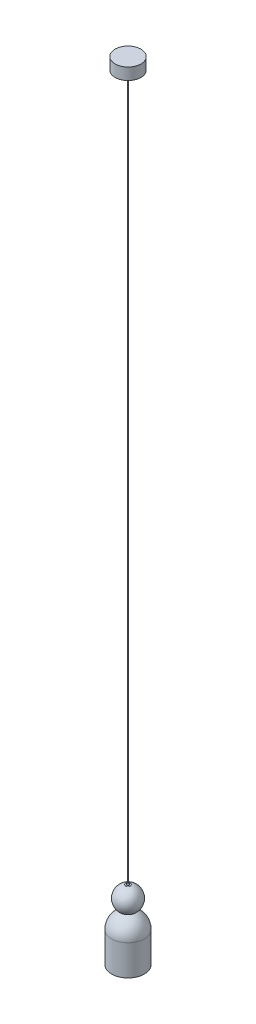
SolidWorks part; units mm, degrees
ref_plane "Alzado" through (0, 0, 0) normal (0, 0, 1) x (1, 0, 0)
ref_plane "Planta" through (0, 0, 0) normal (0, 1, 0) x (1, 0, 0)
ref_plane "Vista lateral" through (0, 0, 0) normal (1, 0, 0) x (0, 0, -1)
sketch "Croquis1" plane through (0, 0, 0) normal (0, 0, 1) x (1, 0, 0)
  line L0 (0, 0) -> (-70, 0)
  line L1 (0, 0) -> (0, 200)
  line L2 (0, 200) -> (0, 160.6502)
  line L3 (-70, 0) -> (-70, 130)
  arc A1 (0, 200) -> (-70, 130) centre (0, 130) ccw
revolve "Revolución1" add sketch "Croquis1" angle 360 about L1
shell "Vaciado1" thickness 3
ref_plane "Plano1" through (0, 200, 0) normal (0, 1, 0) x (1, 0, 0)
sketch "Croquis2" plane through (0, 0, 0) normal (1, 0, 0) x (0, 0, -1)
  line L0 (0, 195.2557) -> (0, 295.2557)
  arc A0 (0, 295.2557) -> (0, 195.2557) centre (0, 245.2557) ccw
revolve "Revolución2" add sketch "Croquis2" angle 360 about L0
ref_plane "Plano2" through (0, 295, 0) normal (0, 1, 0) x (1, 0, 0)
sketch "Croquis3" plane through (0, 295, 0) normal (0, 1, 0) x (1, 0, 0)
  circle A0 centre (0, 0) radius 5
extrude "Saliente-Extruir1" add sketch "Croquis3" along normal blind 10 separate body
sketch "Croquis4" plane through (0, 295, 0) normal (0, 1, 0) x (1, 0, 0)
  circle A0 centre (0, 0) radius 10
extrude "Saliente-Extruir2" add sketch "Croquis4" along normal blind 1 separate body
sketch "Croquis5" plane through (0, 305, 0) normal (0, 1, 0) x (1, 0, 0)
  circle A0 centre (0, 0) radius 1.5
extrude "Saliente-Extruir3" add sketch "Croquis5" along normal blind 3000 separate body
sketch "Croquis6" plane through (0, 3305, 0) normal (0, 1, 0) x (1, 0, 0)
  circle A0 centre (0, 0) radius 54.991
  dimension "D1" = 109.982
extrude "Saliente-Extruir4" add sketch "Croquis6" along normal blind 50.038
